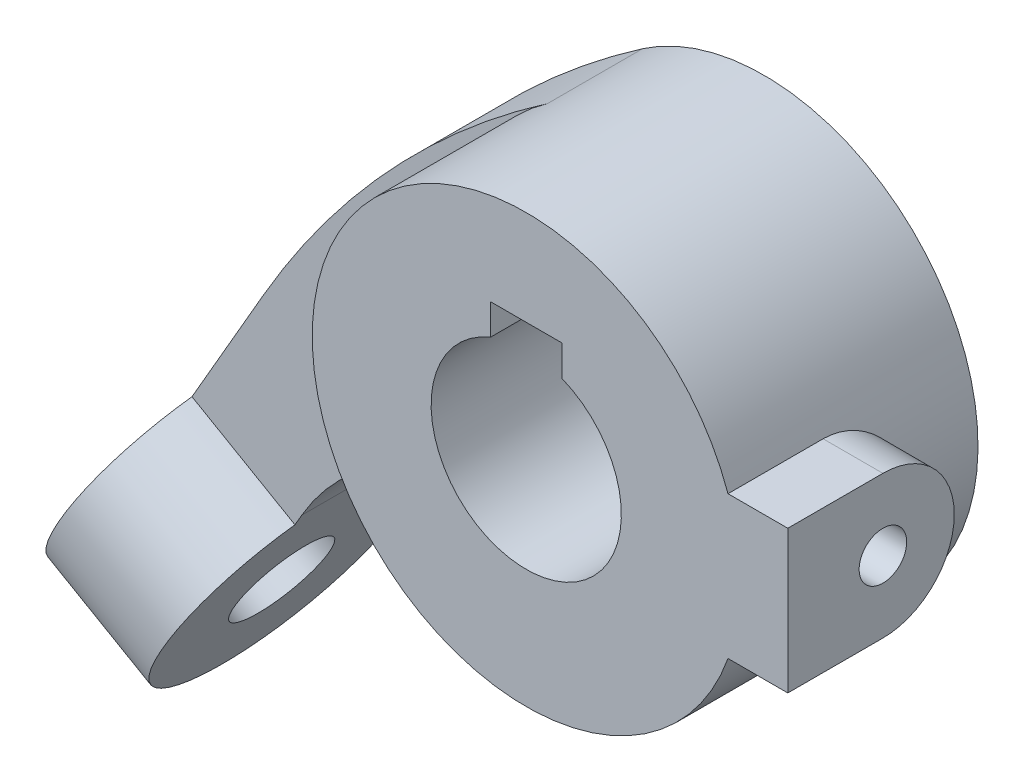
SolidWorks part; units mm, degrees
ref_plane "前视基准面" through (0, 0, 0) normal (0, 0, 1) x (1, 0, 0)
ref_plane "上视基准面" through (0, 0, 0) normal (0, 1, 0) x (1, 0, 0)
ref_plane "右视基准面" through (0, 0, 0) normal (1, 0, 0) x (0, 0, -1)
sketch "草图1" plane through (0, 0, 0) normal (0, 0, 1) x (1, 0, 0)
  line L0 (0, 11.715) -> (0, -12.6704) construction
  line L1 (-12.634, 0) -> (12.1078, 0) construction
  line L2 (-3, 7.4162) -> (-3, 10)
  line L3 (-3, 10) -> (3, 10)
  line L4 (3, 7.4162) -> (3, 10)
  arc A0 (-3, 7.4162) -> (3, 7.4162) centre (0, 0) ccw
  circle A1 centre (0, 0) radius 18
  point P13 (0, 10)
  dimension "D1" = 36
  dimension "D2" = 16
  dimension "D4" = 10
  dimension "D3" = 6
extrude "凸台-拉伸1" add sketch "草图1" along normal blind 20
ref_plane "基准面1" through (22, 0, 0) normal (1, 0, 0) x (0, 0, -1)
sketch "草图2" plane through (22, 0, 0) normal (1, 0, 0) x (0, 0, -1)
  line L0 (-24.8754, 0) -> (-6.9723, 0) construction
  line L1 (-12, 6.7466) -> (-12, -9.8402) construction
  line L2 (-20, 18) -> (-20, -18) construction
  line L3 (-12, 6) -> (-20, 6)
  line L4 (-12, -6) -> (-20, -6)
  line L5 (-20, 6) -> (-20, -6)
  arc A1 (-12, -6) -> (-12, 6) centre (-12, 0) ccw
  dimension "D1" = 6
  dimension "D3" = 8
extrude "凸台-拉伸2" add sketch "草图2" against normal up to surface (16.7085 mm away)
sketch "草图3" plane through (0, 0, 0) normal (0, 0, 1) x (1, 0, 0)
  line L0 (-34.0887, -11.0434) -> (-44.7846, -29.5692)
  line L1 (-30.886, -25.4962) -> (-36.1244, -34.5692)
  line L2 (-64.6804, -18.0824) -> (-14.5619, -47.0183) construction
  line L3 (0, 0) -> (-40.1698, -69.5762) construction
  line L4 (0, 0) -> (-50.4077, 29.1029) construction
  line L5 (-44.7846, -29.5692) -> (-36.1244, -34.5692)
  arc A0 (-10.2174, 14.8191) -> (-6.4258, -16.814) centre (0, 0) ccw
  arc A1 (-6.4258, -16.814) -> (-30.886, -25.4962) centre (-13.5655, -35.4962) ccw
  arc A2 (-10.2174, 14.8191) -> (-34.0887, -11.0434) centre (35.1933, -51.0434) ccw
  dimension "D4" = 40
  dimension "D5" = 36
  dimension "D6" = 160
  dimension "D1" = 48
  dimension "D2" = 24
  dimension "D3" = 14
extrude "凸台-拉伸3" add sketch "草图3" along normal blind 8
ref_plane "基准面2" through (-20.7846, 12, 0) normal (-0.866, 0.5, 0) x (0, 0, 1)
sketch "草图4" plane through (-20.7846, 12, 0) normal (-0.866, 0.5, 0) x (0, 0, 1)
  line L0 (-10.5902, -48) -> (19.4775, -48) construction
  line L1 (4.4436, -35.1861) -> (4.4436, -67.7123) construction
  circle A1 centre (4.4436, -48) radius 10
  dimension "D2" = 20
extrude "凸台-拉伸4" add sketch "草图4" against normal blind 10
sketch "草图5" plane through (-20.7846, 12, 0) normal (-0.866, 0.5, 0) x (0, 0, 1)
  circle A0 centre (4.4436, -48) radius 4
  dimension "D1" = 8
extrude "切除-拉伸1" cut sketch "草图5" against normal blind 11
sketch "草图7" plane through (22, 0, 0) normal (1, 0, 0) x (0, 0, -1)
  circle A0 centre (-12, 0) radius 2
  dimension "D1" = 4
extrude "切除-拉伸2" cut sketch "草图7" against normal blind 20
